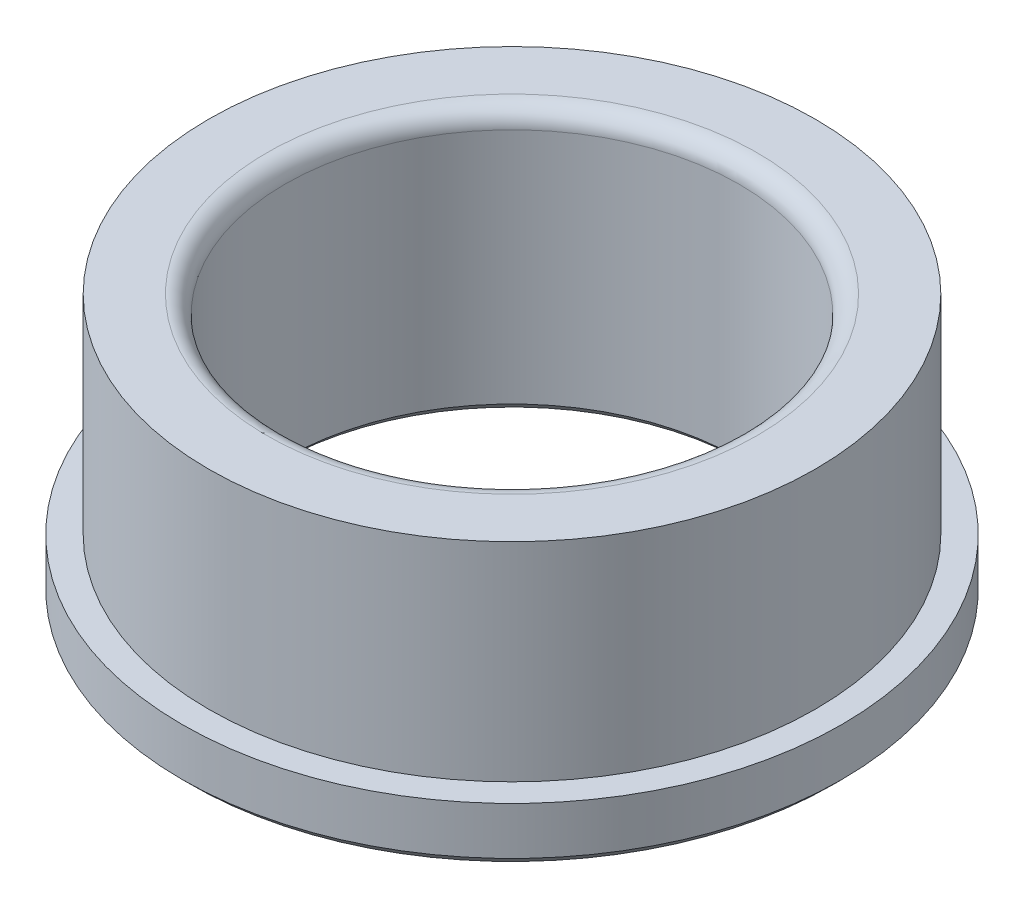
SolidWorks part; units mm, degrees
ref_plane "Front Plane" through (0, 0, 0) normal (0, 0, 1) x (1, 0, 0)
ref_plane "Top Plane" through (0, 0, 0) normal (0, 1, 0) x (1, 0, 0)
ref_plane "Right Plane" through (0, 0, 0) normal (1, 0, 0) x (0, 0, -1)
sketch "Sketch1" plane through (0, 0, 0) normal (0, 0, 1) x (1, 0, 0)
  line L0 (-26.924, 0) -> (-27.686, 0.762)
  line L1 (0, -1000) -> (0, 49000) construction
  line L2 (-19.0563, 22.225) -> (-19.0563, 0.762)
  line L3 (-19.8183, 0) -> (-26.924, 0)
  line L4 (-27.686, 0.762) -> (-27.686, 4.7625)
  line L5 (-27.686, 4.7625) -> (-25.4635, 4.7625)
  line L6 (-25.4635, 22.225) -> (-25.4635, 4.7625)
  line L7 (-25.4635, 22.225) -> (-19.0563, 22.225)
  line L8 (-19.8183, 0) -> (-19.0563, 0.762)
  dimension "OD" = 50.927
  dimension "ID" = 38.1127
  dimension "H" = 55.372
  dimension "D2" = 45
  dimension "OVERALL LENGTH" = 22.225
  dimension "D4" = 0.762
  dimension "D5" = 135
  dimension "T" = 4.7625
revolve "Revolve1" add sketch "Sketch1" angle 360 about L1
fillet "Fillet1" radius 1.524 1 edges at (19.0563, 22.225, 0)
